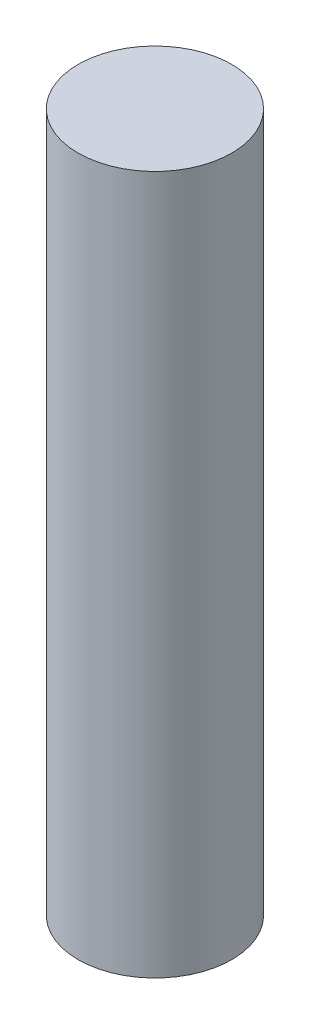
SolidWorks part; units mm, degrees
ref_plane "Plan de face" through (0, 0, 0) normal (0, 0, 1) x (1, 0, 0)
ref_plane "Plan de dessus" through (0, 0, 0) normal (0, 1, 0) x (1, 0, 0)
ref_plane "Plan de droite" through (0, 0, 0) normal (1, 0, 0) x (0, 0, -1)
sketch "Esquisse1" plane through (0, 0, 0) normal (0, 1, 0) x (1, 0, 0)
  circle A1 centre (0, 0) radius 110
extrude "Forme extérieure" add sketch "Esquisse1" along normal blind 1000
